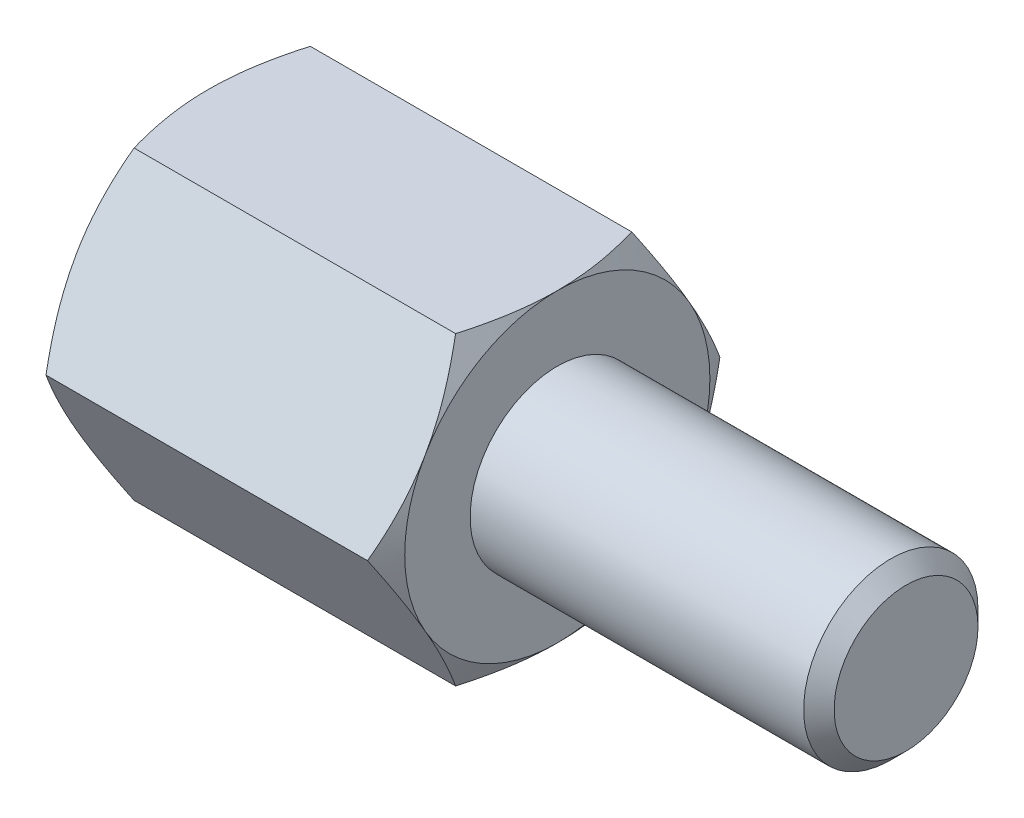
SolidWorks part; units mm, degrees
ref_plane "Front Plane" through (0, 0, 0) normal (0, 0, 1) x (1, 0, 0)
ref_plane "Top Plane" through (0, 0, 0) normal (0, 1, 0) x (1, 0, 0)
ref_plane "Right Plane" through (0, 0, 0) normal (1, 0, 0) x (0, 0, -1)
sketch "Sketch1" plane through (0, 0, 0) normal (1, 0, 0) x (0, 0, -1)
  line L1 (2.0207, 3.5) -> (-2.0207, 3.5)
  line L2 (-2.0207, 3.5) -> (-4.0415, 0)
  line L3 (-4.0415, 0) -> (-2.0207, -3.5)
  line L4 (-2.0207, -3.5) -> (2.0207, -3.5)
  line L5 (2.0207, -3.5) -> (4.0415, 0)
  line L6 (4.0415, 0) -> (2.0207, 3.5)
  circle A0 centre (0, 0) radius 3.5 construction
  dimension "D1" = 7
extrude "Extrude2" add sketch "Sketch1" along normal mid plane 8
sketch "Sketch2" plane through (0, 0, 0) normal (0, 0, 1) x (1, 0, 0)
  line L0 (-4, 3.5) -> (-2.5, 6.0981)
  line L1 (-4, 6.5) -> (-4, 3.5)
  line L3 (0, 0) -> (50000, 0) construction
  arc A0 (-2.5, 6.0981) -> (-4, 6.5) centre (-3.1962, 6.5) ccw
  dimension "D1" = 30
  dimension "D2" = 3
revolve "Cut-Revolve1" cut sketch "Sketch2" angle 360 about L3
mirror "Mirror1" about plane through (0, 0, 0) normal (1, 0, 0) of "Cut-Revolve1"
sketch "Sketch3" plane through (-4, 0, 0) normal (-1, 0, 0) x (0, 0, 1)
  circle A0 centre (0, 0) radius 1.65
  dimension "D1" = 3.3
extrude "Extrude3" cut sketch "Sketch3" against normal blind 5
sketch "Sketch4" plane through (0, 0, 0) normal (0, 0, 1) x (1, 0, 0)
  line L0 (1, 0) -> (1, 1.65)
  line L1 (3.6874, 0) -> (-3.6874, 0) construction
  line L2 (1, 1.65) -> (1.9526, 0)
  line L3 (1.9526, 0) -> (1, 0)
  line L4 (-4, 1.75) -> (-4, -1.75) construction
  point P4 (-4, 0)
  dimension "D1" = 30
  dimension "D2" = 1.65
  dimension "D3" = 5
revolve "Cut-Revolve2" cut sketch "Sketch4" angle 360 about L3
sketch "Sketch5" plane through (4, 0, 0) normal (1, 0, 0) x (0, 0, -1)
  circle A0 centre (0, 0) radius 2
  dimension "D1" = 4
extrude "Extrude4" add sketch "Sketch5" along normal blind 8
chamfer "Chamfer1" distance 0.35 angle 45 1 edges at (12, 0, -2)
equation "\"D2@Sketch4\" = \"D1@Sketch3\"/2"
